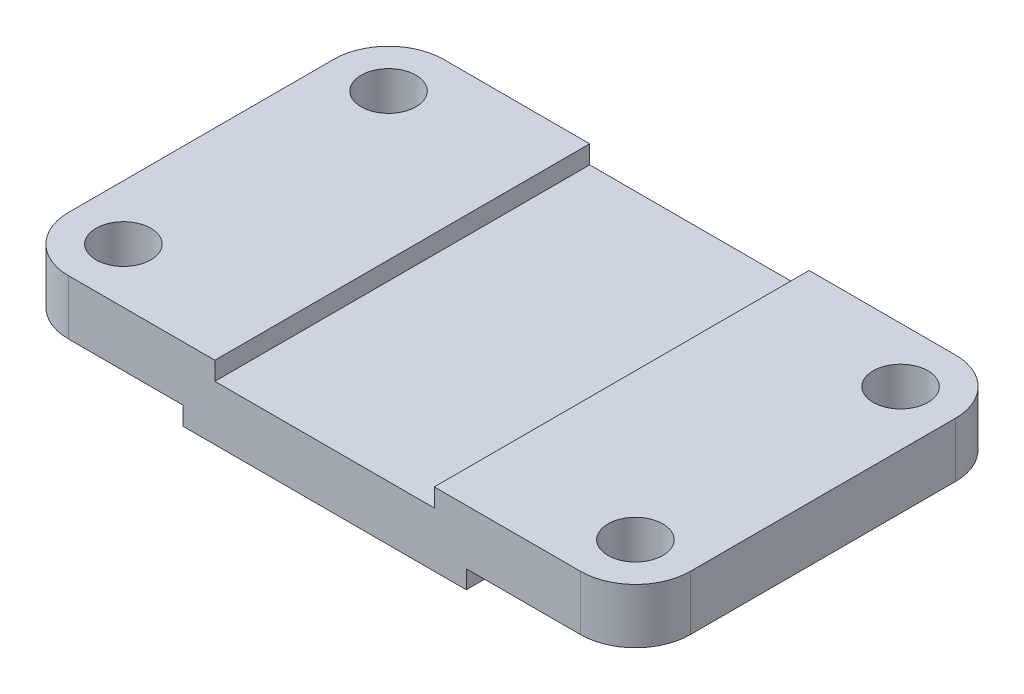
SolidWorks part; units mm, degrees
ref_plane "Front Plane" through (0, 0, 0) normal (0, 0, 1) x (1, 0, 0)
ref_plane "Top Plane" through (0, 0, 0) normal (0, 1, 0) x (1, 0, 0)
ref_plane "Right Plane" through (0, 0, 0) normal (1, 0, 0) x (0, 0, -1)
sketch "Sketch1" plane through (0, 0, 0) normal (0, 0, 1) x (1, 0, 0)
  line L0 (-31, 0) -> (31, 0)
  line L1 (31, 0) -> (31, 4)
  line L2 (31, 4) -> (68, 4)
  line L3 (68, 4) -> (68, 16)
  line L4 (68, 16) -> (24, 16)
  line L8 (-24, 16) -> (-68, 16)
  line L9 (-68, 16) -> (-68, 4)
  line L10 (-68, 4) -> (-31, 4)
  line L11 (-31, 4) -> (-31, 0)
  line L12 (0, 38.9166) -> (0, -28.7857) construction
  line L13 (-24, 16) -> (-24, 12)
  line L14 (-24, 12) -> (24, 12)
  line L15 (24, 12) -> (24, 16)
  point P15 (-67, 19.1196)
  point P16 (-67, 17.0325)
  dimension "D1" = 62
  dimension "D2" = 37
  dimension "D3" = 44
  dimension "D4" = 48
  dimension "D5" = 12
  dimension "D6" = 4
extrude "Boss-Extrude1" add sketch "Sketch1" along normal mid plane 82
fillet "Fillet1" radius 12 4 edges at (-68, 10, -41) (68, 10, -41) (68, 10, 41) (-68, 10, 41)
sketch "Sketch2" plane through (0, 16, 0) normal (0, 1, 0) x (1, 0, 0)
  circle A0 centre (-56, 29) radius 6
  circle A1 centre (56, 29) radius 6
  circle A2 centre (56, -29) radius 6
  circle A3 centre (-56, -29) radius 6
  arc A4 (-68, -29) -> (-56, -41) centre (-56, -29) ccw construction
  dimension "D1" = 58
  dimension "D2" = 112
  dimension "D3" = 12
extrude "Cut-Extrude1" cut sketch "Sketch2" against normal blind 82
